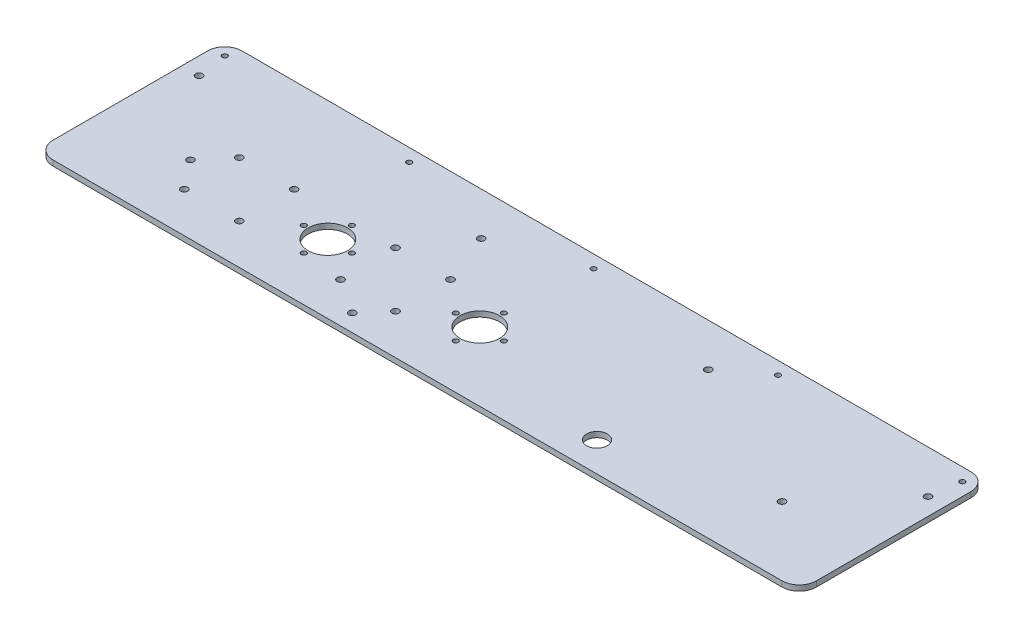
SolidWorks part; units mm, degrees
ref_plane "Front" through (0, 0, 0) normal (0, 0, 1) x (1, 0, 0)
ref_plane "Top" through (0, 0, 0) normal (0, 1, 0) x (1, 0, 0)
ref_plane "Right" through (0, 0, 0) normal (1, 0, 0) x (0, 0, -1)
sketch "Sketch1" plane through (0, 0, 0) normal (0, 1, 0) x (1, 0, 0)
  line L0 (-26.7996, 0) -> (-26.7996, 40)
  line L1 (-26.7996, 0) -> (417.7004, 0)
  line L2 (-26.7996, 0) -> (-26.7996, 110)
  line L3 (-26.7996, 110) -> (417.7004, 110)
  line L4 (417.7004, 0) -> (417.7004, 110)
  line L5 (-26.7996, 40) -> (23.2004, 40)
  line L6 (417.7004, 0) -> (417.7004, 40)
  line L7 (417.7004, 40) -> (367.7004, 40)
  line L8 (23.2004, 40) -> (103.2004, 40)
  line L9 (367.7004, 40) -> (191.7004, 40)
  line L10 (-26.7996, 110) -> (-26.7996, 85)
  line L11 (-26.7996, 85) -> (417.7004, 85)
  line L12 (-26.7996, 85) -> (-16.7996, 85)
  line L13 (417.7004, 85) -> (407.7004, 85)
  line L14 (103.2004, 40) -> (191.7004, 40)
  line L15 (147.4504, 40) -> (147.4504, 85)
  line L16 (279.7004, 40) -> (279.7004, 85)
  line L17 (147.4504, 40) -> (147.4504, 10)
  line L18 (-26.7996, 110) -> (-26.7996, 102.5)
  line L19 (-26.7996, 102.5) -> (417.7004, 102.5)
  line L20 (-26.7996, 102.5) -> (-19.2996, 102.5)
  line L21 (417.7004, 102.5) -> (410.2004, 102.5)
  line L22 (195.4504, 102.5) -> (410.2004, 102.5)
  line L23 (-19.2996, 102.5) -> (195.4504, 102.5)
  line L24 (417.7004, 0) -> (417.7004, 17.2282)
  line L25 (417.7004, 17.2282) -> (282.7004, 17.2282)
  circle A10 centre (367.7004, 40) radius 2
  circle A11 centre (23.2004, 40) radius 2
  circle A12 centre (103.2004, 40) radius 11.5
  circle A13 centre (103.2004, 40) radius 14
  circle A15 centre (103.2004, 54) radius 1.5
  circle A16 centre (89.2004, 40) radius 1.5
  circle A17 centre (103.2004, 26) radius 1.5
  circle A18 centre (117.2004, 40) radius 1.5
  circle A19 centre (191.7004, 40) radius 11.5
  circle A20 centre (191.7004, 40) radius 14
  circle A21 centre (191.7004, 26) radius 1.5
  circle A22 centre (205.7004, 40) radius 1.5
  circle A23 centre (191.7004, 54) radius 1.5
  circle A24 centre (177.7004, 40) radius 1.5
  circle A25 centre (-16.7996, 85) radius 2
  circle A26 centre (407.7004, 85) radius 2
  circle A27 centre (147.4504, 85) radius 2
  circle A28 centre (279.7004, 85) radius 2
  circle A29 centre (147.4504, 10) radius 2
  circle A30 centre (195.4504, 102.5) radius 1.5
  circle A31 centre (-19.2996, 102.5) radius 1.5
  circle A32 centre (410.2004, 102.5) radius 1.5
  circle A33 centre (302.8254, 102.5) radius 1.5
  circle A34 centre (88.0754, 102.5) radius 1.5
  circle A35 centre (282.7004, 17.2282) radius 6
  dimension "D3" = 40
  dimension "D7" = 80
  dimension "D8" = 176
  dimension "D9" = 25
  dimension "D11" = 10
  dimension "D12" = 30
  dimension "D13" = 7.5
  dimension "D14" = 7.5
  dimension "D16" = 17.2282
  dimension "D1" = 110
  dimension "D2" = 444.5
  dimension "D4" = 50
  dimension "D5" = 40
  dimension "D6" = 50
  dimension "D10" = 10
  dimension "D15" = 7.5
  dimension "D17" = 135
extrude "Boss-Extrude1" add sketch "Sketch1" along normal blind 3.175
fillet "Fillet1" radius 10 4 edges at (417.7004, 1.5875, -110) (417.7004, 1.5875, 0) (-26.7996, 1.5875, 0) (-26.7996, 1.5875, -110)
sketch "Sketch2" plane through (0, 3.175, 0) normal (0, 1, 0) x (1, 0, 0)
  line L0 (-26.7996, 55.4056) -> (36.2004, 55.4056)
  line L1 (-26.7996, 10) -> (-26.7996, 100) construction
  line L2 (36.2004, 55.4056) -> (68.2004, 55.4056)
  line L3 (-16.7996, 110) -> (407.7004, 110) construction
  line L4 (36.2004, 55.4056) -> (36.2004, 23.4056)
  line L5 (36.2004, 23.4056) -> (68.2004, 23.4056)
  line L6 (68.2004, 55.4056) -> (159.2004, 55.4056)
  line L7 (159.2004, 55.4056) -> (127.2004, 55.4056)
  circle A0 centre (36.2004, 55.4056) radius 2
  circle A1 centre (68.2004, 55.4056) radius 2
  circle A2 centre (36.2004, 23.4056) radius 2
  circle A3 centre (68.2004, 23.4056) radius 2
  circle A4 centre (127.2004, 55.4056) radius 2
  circle A5 centre (159.2004, 55.4056) radius 2
  circle A7 centre (159.2004, 23.4056) radius 2
  circle A8 centre (127.2004, 23.4056) radius 2
  dimension "D5" = 91
  dimension "D6" = 32
  dimension "D1" = 63
  dimension "D2" = 32
  dimension "D3" = 54.5944
  dimension "D4" = 32
extrude "Cut-Extrude1" cut sketch "Sketch2" against normal blind 10 contours A0 | A1 | A2 | A3 | A4 | A8 | A7 | A5
